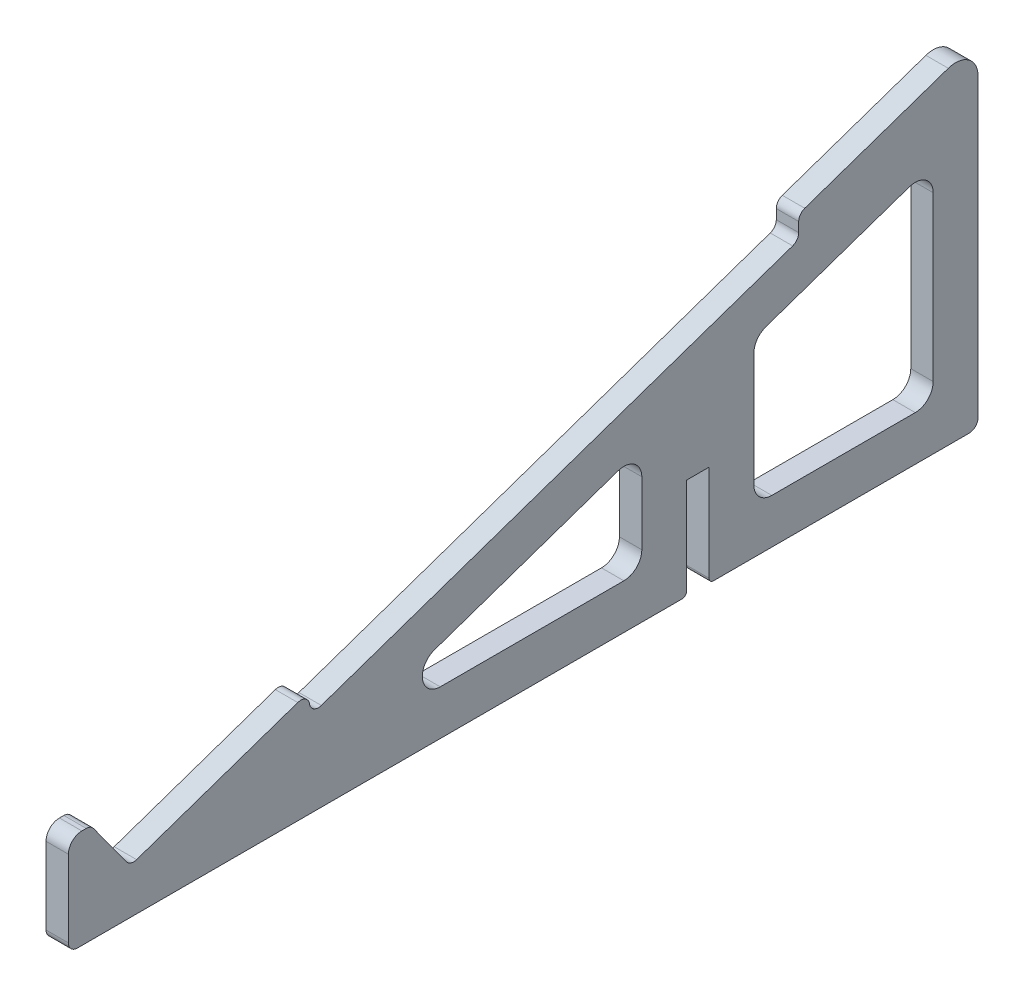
SolidWorks part; units mm, degrees
ref_plane "Front Plane" through (0, 0, 0) normal (0, 0, 1) x (1, 0, 0)
ref_plane "Top Plane" through (0, 0, 0) normal (0, 1, 0) x (1, 0, 0)
ref_plane "Right Plane" through (0, 0, 0) normal (1, 0, 0) x (0, 0, -1)
sketch "Sketch1" plane through (0, 0, 0) normal (1, 0, 0) x (0, 0, -1)
  line L0 (-128.8545, 0) -> (128.8545, 0)
  line L1 (128.8545, 0) -> (128.8545, 95.3943)
  line L2 (128.8545, 95.3943) -> (-111.3072, 12.7)
  line L3 (-111.3072, 12.7) -> (-122.5045, 28.1118)
  line L4 (-122.5045, 28.1118) -> (-128.8545, 28.1118)
  line L5 (-128.8545, 0) -> (-128.8545, 28.1118)
  point P3 (0, 0)
  dimension "D1" = 254
  dimension "D2" = 19
  dimension "D3" = 6.35
  dimension "D4" = 19.05
  dimension "D5" = 12.7
  dimension "D6" = 107
extrude "Main Body" add sketch "Sketch1" along normal blind 6.35
sketch "Sketch2" plane through (6.35, 0, 0) normal (1, 0, 0) x (0, 0, -1)
  line L0 (78.0545, 77.9025) -> (78.0545, 71.5525)
  line L1 (128.8545, 95.3943) -> (-111.3072, 12.7) construction
  line L2 (78.0545, 71.5525) -> (-60.5072, 23.8418)
  line L3 (-60.5072, 30.1918) -> (78.0545, 77.9025)
  line L4 (128.8545, 0) -> (128.8545, 95.3943) construction
  line L5 (-60.5072, 23.8418) -> (-60.5072, 30.1918)
  dimension "D1" = 50.8
  dimension "D2" = 6.35
  dimension "D3" = 50.8
extrude "Lip Cut" cut sketch "Sketch2" against normal through all
fillet "Fillet1" radius 2.54 2 edges at (3.175, 77.9025, -78.0545) (3.175, 30.1918, 60.5072)
fillet "Fillet2" radius 2.54 6 edges at (3.175, 12.7, 111.3072) (3.175, 71.5525, -78.0545) (3.175, 23.8418, 60.5072) (3.175, 28.1118, 122.5045) (3.175, 0, -128.8545) (3.175, 0, 128.8545)
fillet "Fillet3" radius 3.81 1 edges at (3.175, 28.1118, 128.8545)
fillet "Fillet4" radius 6.35 1 edges at (3.175, 95.3943, -128.8545)
sketch "Sketch3" plane through (6.35, 0, 0) normal (1, 0, 0) x (0, 0, -1)
  line L0 (52.6545, 0) -> (52.6545, 28.5165)
  line L1 (-126.3145, 0) -> (126.3145, 0) construction
  line L2 (52.6545, 28.5165) -> (46.3045, 28.5165)
  line L3 (46.3045, 28.5165) -> (46.3045, 0)
  line L4 (46.3045, 0) -> (52.6545, 0)
  line L5 (128.8545, 2.54) -> (128.8545, 86.4919) construction
  line L6 (52.6545, 28.5165) -> (46.3045, 28.5165) construction
  dimension "D1" = 76.2
  dimension "D2" = 6.35
extrude "Notch Cut" cut sketch "Sketch3" against normal through all
sketch "Sketch4" plane through (6.35, 0, 0) normal (1, 0, 0) x (0, 0, -1)
  line L0 (65.3545, 12.7) -> (116.1545, 12.7)
  line L1 (116.1545, 12.7) -> (116.1545, 71.2396)
  line L2 (116.1545, 71.2396) -> (65.3545, 53.7477)
  line L3 (65.3545, 53.7477) -> (65.3545, 12.7)
  line L4 (33.6045, 12.7) -> (33.6045, 42.8153)
  line L5 (33.6045, 42.8153) -> (-53.8567, 12.7)
  line L6 (-53.8567, 12.7) -> (33.6045, 12.7)
  line L7 (-57.1963, 24.9819) -> (76.3415, 70.9626) construction
  line L8 (33.6045, 12.7) -> (46.3045, 12.7) construction
  line L9 (46.3045, 28.5165) -> (46.3045, 0) construction
  line L10 (65.3545, 12.7) -> (52.6545, 12.7) construction
  line L11 (52.6545, 0) -> (52.6545, 28.5165) construction
  line L12 (116.1545, 12.7) -> (116.1545, 0) construction
  line L13 (52.6545, 0) -> (126.3145, 0) construction
  line L14 (116.1545, 12.7) -> (128.8545, 12.7) construction
  line L15 (128.8545, 2.54) -> (128.8545, 86.4919) construction
  line L16 (65.3545, 53.7477) -> (61.2198, 65.7558) construction
  dimension "D1" = 12.7
extrude "Weight Cut" cut sketch "Sketch4" against normal through all
fillet "Fillet5" radius 5.08 7 edges at (3.175, 12.7, -116.1545) (3.175, 12.7, -33.6045) (3.175, 12.7, -65.3545) (3.175, 12.7, 53.8567) (3.175, 71.2396, -116.1545) (3.175, 42.8153, -33.6045) (3.175, 53.7477, -65.3545)
fillet "Fillet6" radius 1.27 2 edges at (3.175, 0, -52.6545) (3.175, 0, -46.3045)
